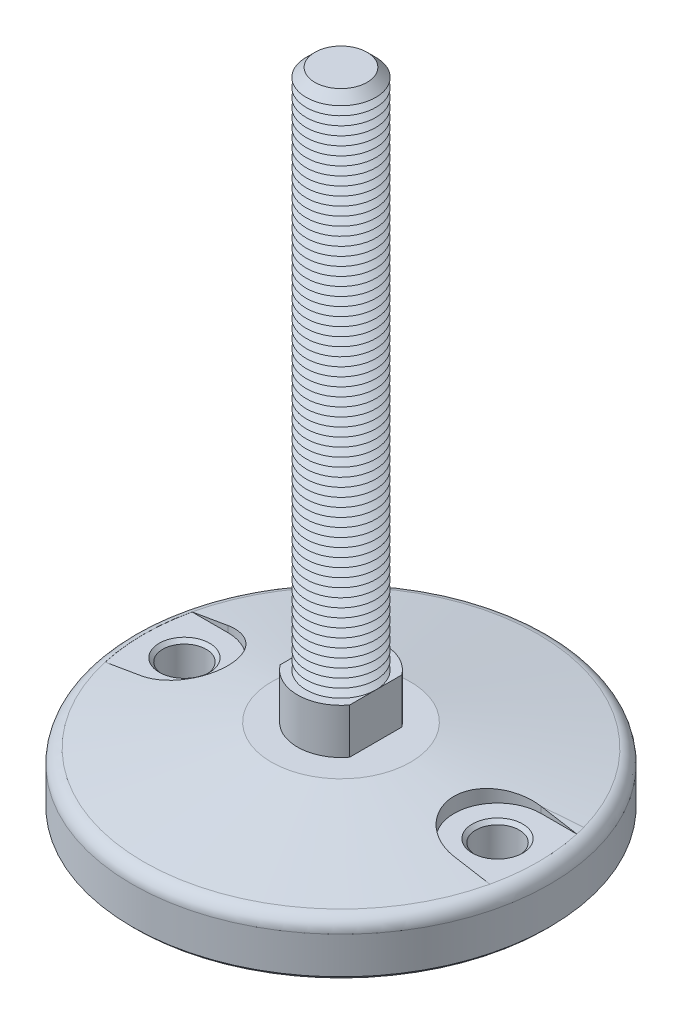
SolidWorks part; units mm, degrees
ref_plane "Front Plane" through (0, 0, 0) normal (0, 0, 1) x (1, 0, 0)
ref_plane "Top Plane" through (0, 0, 0) normal (0, 1, 0) x (1, 0, 0)
ref_plane "Right Plane" through (0, 0, 0) normal (1, 0, 0) x (0, 0, -1)
sketch "Sketch1" plane through (0, 0, 0) normal (1, 0, 0) x (0, 0, -1)
  line L0 (0, 61.3389) -> (0, -58.404) construction
sketch "Sketch2" plane through (0, 0, 0) normal (1, 0, 0) x (0, 0, -1)
  line L0 (0, 0) -> (-20, 0)
  line L1 (-20, 0) -> (-60, -7.0531)
  line L2 (-60, -7.0531) -> (-60, -22)
  line L3 (-60, -22) -> (0, -22)
  line L4 (0, 61.3389) -> (0, -58.404) construction
  line L5 (0, -22) -> (0, 0)
  dimension "D1" = 22
  dimension "D2" = 60
  dimension "D3" = 20
  dimension "D4" = 10
revolve "Revolve1" add sketch "Sketch2" angle 360 about L0
fillet "Fillet1" radius 4 1 edges at (0, -7.0531, 60)
sketch "Sketch3" plane through (0, 0, 0) normal (0, 1, 0) x (1, 0, 0)
  circle A0 centre (0, 0) radius 12.5
  dimension "D1" = 25
extrude "Boss-Extrude1" add sketch "Sketch3" along normal blind 13
sketch "Sketch4" plane through (0, 13, 0) normal (0, 1, 0) x (1, 0, 0)
  line L0 (-10, 7.5) -> (-10, -7.5)
  line L2 (10, -7.5) -> (10, 7.5)
  arc A0 (-10, 7.5) -> (-10, -7.5) centre (0, 0) ccw
  circle A1 centre (0, 0) radius 12.5 construction
  arc A2 (10, -7.5) -> (10, 7.5) centre (0, 0) ccw
  dimension "D1" = 20
extrude "Cut-Extrude1" cut sketch "Sketch4" against normal blind 13
sketch "Sketch5" plane through (0, 13, 0) normal (0, 1, 0) x (1, 0, 0)
  circle A0 centre (0, 0) radius 10
  dimension "D1" = 20
extrude "Boss-Extrude2" add sketch "Sketch5" along normal blind 150
chamfer "Chamfer1" distance 2.5 angle 45 1 edges at (0, 163, 10)
sketch "Sketch6" plane through (0, 0, 0) normal (1, 0, 0) x (0, 0, -1)
  line L0 (-10, 13) -> (-7.8349, 14.25)
  line L1 (-7.8349, 14.25) -> (-10, 15.5)
  line L2 (-10, 160.5) -> (-10, 13) construction
  line L3 (-10, 15.5) -> (-10, 13)
  dimension "D1" = 2.5
revolve "Cut-Revolve1" cut sketch "Sketch6" angle 360 about L0
pattern_linear "LPattern1" count 59 spacing 2.5 along (0, 1, 0) of "Cut-Revolve1"
sketch "Sketch8" plane through (0, 0, 0) normal (0, 1, 0) x (1, 0, 0)
  line L0 (-45, 12.5) -> (-55.2994, 12.5)
  line L1 (-45, -12.5) -> (-55.2994, -12.5)
  arc A1 (-55.2994, 12.5) -> (-55.2994, -12.5) centre (0, 0) ccw
  circle A2 centre (0, 0) radius 56.6946 construction
  arc A3 (-45, -12.5) -> (-45, 12.5) centre (-45, 0) ccw
  point P3 (-45, 0)
  point P11 (0, 0)
  dimension "D1" = 45
  dimension "D2" = 25
extrude "Cut-Extrude4" cut sketch "Sketch8" against normal blind 6.5
sketch "Sketch10" plane through (0, -6.5, 0) normal (0, 1, 0) x (1, 0, 0)
  circle A0 centre (-45, 0) radius 6.25
  dimension "D1" = 12.5
extrude "Cut-Extrude5" cut sketch "Sketch10" against normal up to surface (15.5 mm away)
chamfer "Chamfer2" distance 1 angle 45 2 edges at (-45, -22, -6.25) (-45, -6.5, 6.25)
mirror "Mirror1" about plane through (0, 0, 0) normal (1, 0, 0) of "Chamfer2", "Cut-Extrude5", "Cut-Extrude4"
chamfer "Chamfer3" distance 1 angle 45 1 edges at (0, -22, 60)
